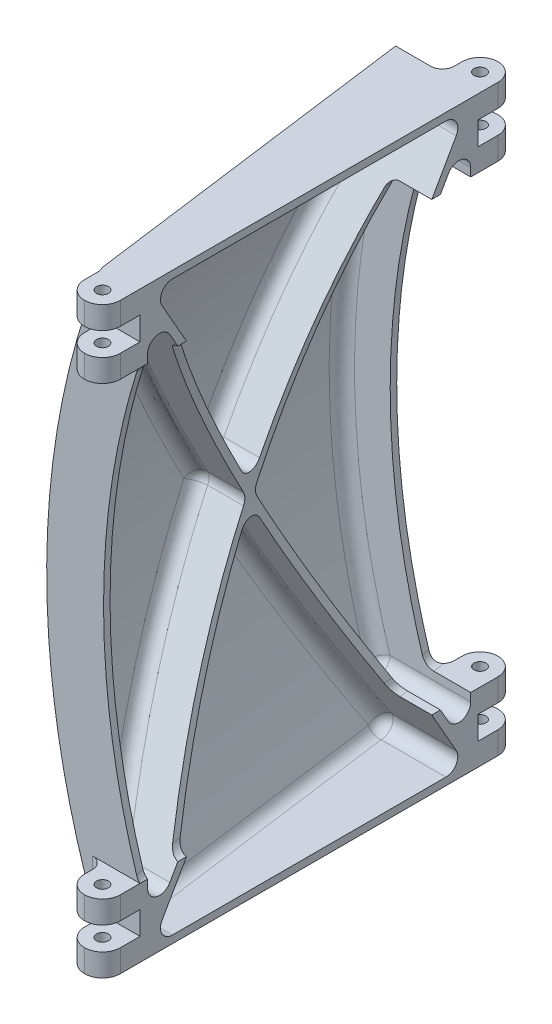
SolidWorks part; units mm, degrees
ref_plane "Front" through (0, 0, 0) normal (0, 0, 1) x (1, 0, 0)
ref_plane "Top" through (0, 0, 0) normal (0, 1, 0) x (1, 0, 0)
ref_plane "Right" through (0, 0, 0) normal (1, 0, 0) x (0, 0, -1)
sketch "Sketch1" plane through (0, 0, 0) normal (0, 1, 0) x (1, 0, 0)
  line L0 (-5, 45) -> (5, -45) construction
  line L1 (-5, 45) -> (5, 45)
  line L2 (-5, 45) -> (-5, -45)
  line L3 (-5, -45) -> (5, -45)
  line L4 (5, 45) -> (5, -45)
  point P4 (0, 0)
  dimension "D1" = 90
  dimension "D2" = 10
extrude "Boss-Extrude1" add sketch "Sketch1" along normal mid plane 155.2
ref_plane "Plane2" through (5.8008, 0, 43.5617) normal (0.132, 0, 0.9912) x (0.9912, 0, -0.132)
sketch "Sketch7" plane through (5.8008, 0, 43.5617) normal (0.132, 0, 0.9912) x (0.9912, 0, -0.132)
  line L0 (-10.8962, 77.6) -> (-10.8962, -77.6) construction
  line L1 (-10.8962, -77.6) -> (-0.9837, -77.6) construction
  line L2 (-10.8962, 77.6) -> (-0.9837, 77.6) construction
  line L11 (-10.8962, 77.6) -> (-10.8962, -77.6)
  arc A0 (-10.8962, 77.6) -> (-10.8962, -77.6) centre (186.391, 0) ccw
  dimension "D2" = 212
extrude "Boss-Extrude5" add sketch "Sketch7" against normal up to surface (90.7945 mm away) separate body
sketch "Sketch8" plane through (0, 77.6, 0) normal (0, 1, 0) x (1, 0, 0)
  line L0 (-16.9847, 45) -> (-5, -45) construction
  line L1 (-16.9847, 45) -> (-5, -45)
  line L2 (-5, 45) -> (-5, -45) construction
  line L3 (-5, 45) -> (-5, -45)
  line L4 (-16.9847, 45) -> (-5, 45)
extrude "Boss-Extrude6" add sketch "Sketch8" against normal up to surface (155.2 mm away)
sketch "Sketch9" plane through (0, 77.6, 0) normal (0, 1, 0) x (1, 0, 0)
  line L0 (-5, -45) -> (-51.1198, -45)
  line L1 (-51.1198, -45) -> (-51.1198, -71.2866)
  line L2 (-51.1198, -71.2866) -> (-5, -45)
  line L3 (-5, -45) -> (5, -45) construction
  dimension "D1" = 46.1198
  dimension "D2" = 26.2866
extrude "Cut-Extrude3" cut sketch "Sketch9" against normal through all
shell "Shell2" thickness 2
sketch "Sketch10" plane through (5, 0, 0) normal (1, 0, 0) x (0, 0, -1)
  line L0 (43, -75.6) -> (-43, 75.6)
extrude "Extrude-Thin1" add sketch "Sketch10" against normal up to surface (20.6466 mm away) thin
sketch "Sketch11" plane through (5, 0, 0) normal (1, 0, 0) x (0, 0, -1)
  line L0 (-43, -75.6) -> (43, 75.6)
extrude "Extrude-Thin2" add sketch "Sketch11" against normal up to surface (8.8096 mm away) thin
fillet "Fillet7" radius 3.175 12 edges at (0.4799, -75.6, 41.8496) (-9.4038, -2.0226, 0) (-5.5572, 73.5774, -43) (-9.4853, 0, -1.1504) (-5.0929, 75.6, -41.8496) (-9.4038, 2.0226, 0) (0.1688, -73.5774, 43) (-9.3321, 0, 1.1504) (-5.5572, -73.5774, -43) (0.4799, 75.6, 41.8496) (-5.0929, -75.6, -41.8496) (0.1688, 73.5774, 43)
fillet "Fillet8" radius 3.175 24 edges at (-23.5927, -0.5774, 1.681) (-18.5989, -32.7188, 19.7603) (-8.1266, -64.6757, 40.5006) (-18.0913, 0, 43) (-8.1112, 64.5673, 40.8819) (-18.5989, 32.7188, 19.7603) (-23.735, 5.2717, 0.1175) (-17.2401, 39.341, 21.226) (-4.9252, 74.3064, 38.9485) (-9.6131, 75.6, 0) (-15.4413, 74.0001, -39.1478) (-22.8931, 39.341, -21.226) (-18.927, -64.6603, -40.5678) (-23.8616, -32.7188, -19.7603) (-24.0403, 0.5743, -1.6805) (-23.8616, 32.7188, -19.7603) (-18.872, 64.7144, -40.2882) (-29.5434, 0, -43) (-15.3584, -74.1796, -39.0372) (-9.6131, -75.6, 0) (-4.9724, -74.1433, 39.0609) (-17.2401, -39.341, 21.226) (-23.7702, -5.2729, -0.1471) (-22.8931, -39.341, -21.226)
sketch "Sketch12" plane through (5.8008, 0, 43.5617) normal (0.132, 0, 0.9912) x (0.9912, 0, -0.132)
  line L0 (-1.4404, -59.4) -> (10.8962, -59.4)
  line L1 (-10.8962, -77.6) -> (-0.9837, -77.6) construction
  line L2 (0, 0) -> (18.2924, 0) construction
  line L3 (10.8962, -59.4) -> (10.8962, 59.4)
  line L8 (-1.4404, 59.4) -> (10.8962, 59.4)
  line L9 (10.8962, 77.6) -> (10.8962, -77.6) construction
  arc A2 (3.0628, 72.1094) -> (3.0628, -72.1094) centre (186.391, 0) ccw
  arc A3 (-1.4404, 59.4) -> (-1.4404, -59.4) centre (186.391, 0) ccw
  dimension "D2" = 18.2
  dimension "D1" = 15
extrude "Cut-Extrude4" cut sketch "Sketch12" against normal through all and the other way through all
sketch "Sketch13" plane through (0, 77.6, 0) normal (0, 1, 0) x (1, 0, 0)
  line L0 (5, 45.475) -> (-4.525, 55) construction
  line L1 (5, 45.475) -> (-4.525, 45.475) construction
  line L2 (5, 45.475) -> (5, 55)
  line L3 (5, 55) -> (-4.525, 55)
  line L4 (-4.525, 45.475) -> (-4.525, 55)
  line L5 (5, 45.475) -> (5, 45)
  line L6 (5, 45) -> (-4.525, 45)
  line L7 (-4.525, 45) -> (-4.525, 45.475)
  circle A0 centre (0.2375, 50.2375) radius 1.5875 construction
  dimension "D3" = 3.175
  dimension "D1" = 9.525
  dimension "D2" = 10
extrude "Boss-Extrude7" add sketch "Sketch13" against normal up to surface (18.2 mm away) separate body
hole_wizard "#31 (0.12) Diameter Hole1" positions "3DSketch1" profile "Sketch15" hole size "#31" standard "Ansi Inch"
sketch3d "3DSketch1"
  point P0 (0.2375, 77.6, -50.2375)
sketch "Sketch15" plane through (0.2375, 77.6, -50.2375) normal (1, 0, 0) x (0, 0, 1)
  line L0 (0, 0) -> (0, 19.1157)
  line L1 (0, 19.1157) -> (1.524, 18.2)
  line L2 (1.524, 18.2) -> (1.524, 0)
  line L5 (1.524, 0) -> (0, 0)
  line L10 (0, 19.1157) -> (-1.524, 18.2) construction
  line L11 (0, -6.35) -> (0, 107.95) construction
  dimension "Hole Dia." = 3.048
  dimension "Hole Depth" = 18.2
  dimension "Drill Angle" = 118
sketch "Sketch14" plane through (5, 0, 0) normal (1, 0, 0) x (0, 0, -1)
  line L0 (45, 59.4) -> (45, 77.6) construction
  line L1 (45, 65.4) -> (55, 65.4)
  line L2 (45, 65.4) -> (45, 71.6)
  line L3 (45, 71.6) -> (55, 71.6)
  line L4 (55, 65.4) -> (55, 71.6)
  line L5 (55, 59.4) -> (55, 77.6) construction
  point P8 (55, 68.5)
  dimension "D1" = 6.2
extrude "Cut-Extrude5" cut sketch "Sketch14" against normal up to surface (9.525 mm away)
sketch "Sketch16" plane through (0, 77.6, 0) normal (0, 1, 0) x (1, 0, 0)
  circle A0 centre (0.2375, 50.2375) radius 1.5913
  dimension "D1" = 3.1826
extrude "ream clearence" cut sketch "Sketch16" against normal up to next
sketch "Sketch17" plane through (0, 65.4, 0) normal (0, 1, 0) x (1, 0, 0)
  circle A0 centre (0.2375, 50.2375) radius 1.5837
  dimension "D1" = 3.1674
extrude "ream interference" cut sketch "Sketch17" against normal up to next
mirror "Mirror1" about plane through (0, 0, 0) normal (0, 1, 0)
mirror "Mirror2" about plane through (0, 0, 0) normal (0, 0, 1)
combine bodies "Combine1" operation type add bodies to combine 116 129 128 130 118 132 131 120 119
fillet "Fillet10" radius 3.175 6 edges at (-4.525, 74.6, -45) (-4.525, -74.6, -45) (-4.525, -74.6, 45) (-4.525, -62.4, 45) (-4.525, 62.4, 45) (-4.525, 74.6, 45)
fillet "Fillet11" radius 4.7625 32 edges at (0.2375, 65.4, -55) (-4.525, 62.4, -55) (5, 62.4, -55) (0.2375, 59.4, -55) (5, 74.6, -55) (-4.525, 74.6, -55) (0.2375, 77.6, -55) (0.2375, 71.6, -55) (-4.525, -62.4, -55) (0.2375, -59.4, -55) (5, -62.4, -55) (0.2375, -65.4, -55) (0.2375, -71.6, -55) (5, -74.6, -55) (0.2375, -77.6, -55) (-4.525, -74.6, -55) (0.2375, -65.4, 55) (-4.525, -62.4, 55) (5, -62.4, 55) (0.2375, -59.4, 55) (-4.525, 62.4, 55) (0.2375, 59.4, 55) (5, 62.4, 55) (0.2375, 65.4, 55) (0.2375, 71.6, 55) (5, 74.6, 55) (0.2375, 77.6, 55) (-4.525, 74.6, 55) (5, -74.6, 55) (-4.525, -74.6, 55) (0.2375, -77.6, 55) (0.2375, -71.6, 55)
fillet "Fillet12" radius 3.175 5 edges at (3.0459, -59.4, 33.7857) (-5.9521, -59.4, -33.7857) (4.4061, 59.4, 44) (-5.9521, 59.4, -33.7857) (3.0459, 59.4, 33.7857)
